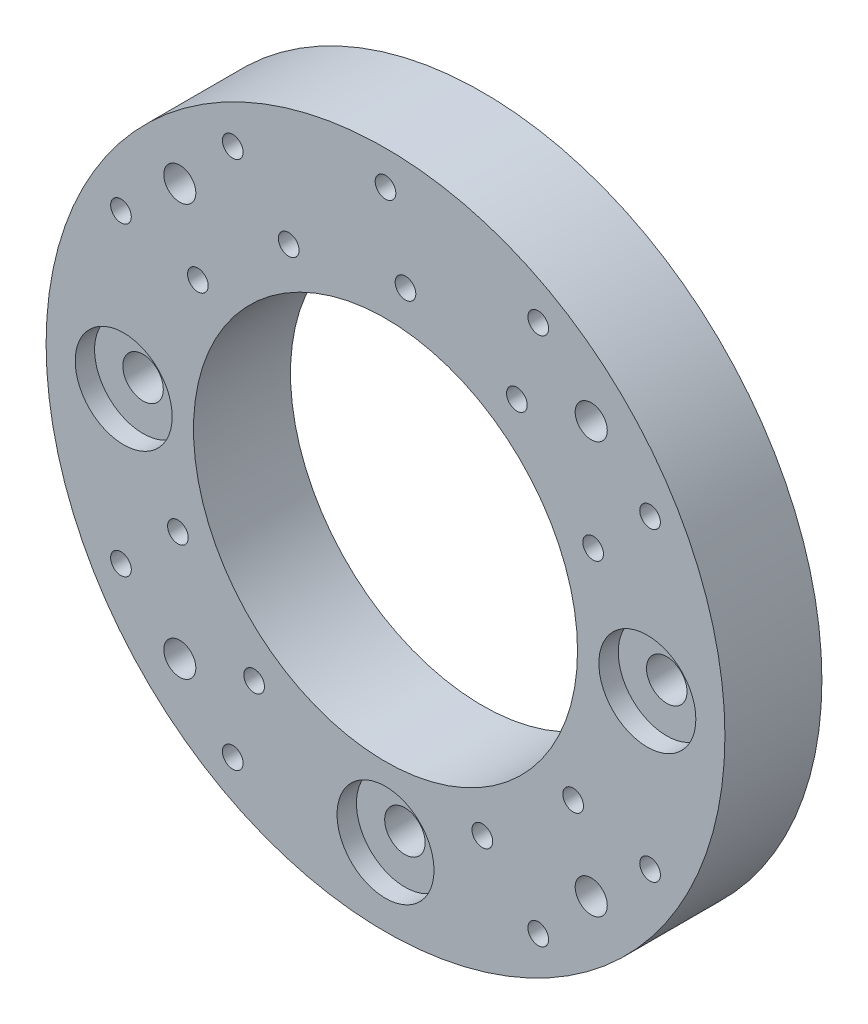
SolidWorks part; units mm, degrees
ref_plane "Front Plane" through (0, 0, 0) normal (0, 0, 1) x (1, 0, 0)
ref_plane "Top Plane" through (0, 0, 0) normal (0, 1, 0) x (1, 0, 0)
ref_plane "Right Plane" through (0, 0, 0) normal (1, 0, 0) x (0, 0, -1)
sketch "Sketch1" plane through (0, 0, 0) normal (0, 0, 1) x (1, 0, 0)
  circle A0 centre (0, 0) radius 25.146
  circle A1 centre (0, 0) radius 44.45
  dimension "D1" = 50.292
  dimension "D2" = 88.9
extrude "Boss-Extrude1" add sketch "Sketch1" along normal blind 12.7
sketch "Sketch2" plane through (0, 0, 0) normal (0, 0, -1) x (-1, 0, 0)
  line L0 (0, 0) -> (34.29, 0) construction
  line L1 (0, 0) -> (-34.29, 0) construction
  line L2 (0, 0) -> (0, -34.29) construction
  point P4 (0, -34.29)
  point P8 (34.29, 0)
  point P12 (-34.29, 0)
  dimension "D1" = 34.29
  dimension "D2" = 34.29
hole_wizard "CSK for M5 SFHCS1" positions "Sketch3" profile "Sketch4" countersink size "M5" standard "ANSI Metric"
sketch "Sketch3" plane through (0, 0, 0) normal (0, 0, -1) x (-1, 0, 0)
  point P0 (-34.29, 0)
  point P3 (0, -34.29)
  point P6 (34.29, 0)
sketch "Sketch4" plane through (34.29, 0, 0) normal (1, 0, 0) x (0, 1, 0)
  line L0 (0, 0) -> (0, 12.7)
  line L1 (0, 12.7) -> (2.65, 12.7)
  line L2 (2.65, 12.7) -> (2.65, 2.95)
  line L3 (2.65, 2.95) -> (5.6, 0)
  line L5 (5.6, 0) -> (0, 0)
  line L6 (-2.65, 2.95) -> (-5.6, 0) construction
  line L11 (0, -6.35) -> (0, 107.95) construction
  dimension "Thru Hole Dia." = 5.3
  dimension "Thru Hole Depth" = 12.7
  dimension "Near C'Sink Dia." = 11.2
  dimension "Near C'Sink Angle" = 90
sketch "Sketch6" plane through (0, 0, 12.7) normal (0, 0, 1) x (1, 0, 0)
  circle A0 centre (-34.29, 0) radius 6.35
  circle A1 centre (34.29, 0) radius 6.35
  circle A2 centre (0, -34.29) radius 6.35
  dimension "D1" = 12.7
extrude "Cut-Extrude1" cut sketch "Sketch6" against normal blind 2.54
sketch "Sketch9" plane through (0, 0, 0) normal (0, 0, -1) x (-1, 0, 0)
  line L0 (-26.9408, 26.9408) -> (0, 0) construction
  line L1 (0, 0) -> (26.9408, 26.9408) construction
  line L2 (0, 0) -> (-26.9408, -26.9408) construction
  line L3 (0, 0) -> (26.9408, -26.9408) construction
  line L4 (0, 0) -> (-18.2312, 0) construction
  point P0 (-26.9408, -26.9408)
  point P1 (26.9408, -26.9408)
  point P2 (26.9408, 26.9408)
  point P3 (-26.9408, 26.9408)
  dimension "D1" = 45
  dimension "D2" = 38.1
hole_wizard "M5 Tapped Hole1" positions "Sketch10" profile "Sketch11" tap size "M5" standard "AS"
sketch "Sketch10" plane through (0, 0, 12.7) normal (0, 0, 1) x (1, 0, 0)
  point P0 (-26.9408, 26.9408)
  point P3 (26.9408, 26.9408)
  point P6 (26.9408, -26.9408)
  point P9 (-26.9408, -26.9408)
sketch "Sketch11" plane through (-26.9408, 26.9408, 12.7) normal (1, 0, 0) x (0, -1, 0)
  line L0 (0, 0) -> (0, 10.7868)
  line L1 (0, 10.7868) -> (2.1, 9.525)
  line L2 (2.1, 9.525) -> (2.1, 0)
  line L5 (2.1, 0) -> (0, 0)
  line L10 (0, 10.7868) -> (-2.1, 9.525) construction
  line L11 (0, -6.35) -> (0, 107.95) construction
  dimension "Tap Drill Dia." = 4.2
  dimension "Tap Drill Depth" = 9.525
  dimension "Drill Angle" = 118
sketch "Sketch13" plane through (0, 0, 0) normal (0, 0, -1) x (-1, 0, 0)
  line L0 (0, 0) -> (0, 40.005) construction
  line L1 (0, 0) -> (12.6774, 27.1869) construction
  point P0 (0, 40.005)
  point P1 (12.6774, 27.1869)
  point P7 (-40.005, 0)
  point P9 (20.0025, 34.6453)
  point P10 (24.5724, 17.2058)
  point P11 (34.6453, 20.0025)
  point P14 (27.1869, -12.6774)
  point P15 (34.6453, -20.0025)
  point P16 (17.2058, -24.5724)
  point P17 (20.0025, -34.6453)
  point P20 (-12.6774, -27.1869)
  point P21 (-20.0025, -34.6453)
  point P22 (-24.5724, -17.2058)
  point P23 (-34.6453, -20.0025)
  point P25 (-29.8833, -2.6144)
  point P26 (-27.1869, 12.6774)
  point P27 (-34.6453, 20.0025)
  point P28 (-17.2058, 24.5724)
  point P29 (-20.0025, 34.6453)
  point P30 (-2.6144, 29.8833)
  point P31 (0, 0)
  point P32 (2.6144, -29.8833)
  point P33 (0, -40.005)
  point P34 (40.005, 0)
  point P35 (29.8833, 2.6144)
  dimension "D1" = 40.005
  dimension "D2" = 29.9974
  dimension "D3" = 25
  dimension "D5" = 29.9974
  dimension "D6" = 15.5278
  dimension "D4" = 12
hole_wizard "#6-32 Tapped Hole2" positions "Sketch16" profile "Sketch17" tap size "#6-32" standard "ANSI Inch"
sketch "Sketch16" plane through (0, 0, 0) normal (0, 0, -1) x (-1, 0, 0)
  point P0 (-17.2058, 24.5724)
  point P3 (-20.0025, 34.6453)
  point P6 (0, 40.005)
  point P9 (-2.6144, 29.8833)
  point P12 (20.0025, 34.6453)
  point P15 (12.6774, 27.1869)
  point P18 (24.5724, 17.2058)
  point P21 (34.6453, 20.0025)
  point P24 (27.1869, -12.6774)
  point P27 (34.6453, -20.0025)
  point P30 (20.0025, -34.6453)
  point P33 (17.2058, -24.5724)
  point P36 (-12.6774, -27.1869)
  point P39 (-20.0025, -34.6453)
  point P42 (-24.5724, -17.2058)
  point P45 (-34.6453, -20.0025)
  point P48 (-27.1869, 12.6774)
  point P51 (-34.6453, 20.0025)
sketch "Sketch17" plane through (17.2058, 24.5724, 0) normal (1, 0, 0) x (0, 1, 0)
  line L0 (0, 0) -> (0, 12.7)
  line L1 (0, 12.7) -> (1.3525, 12.7)
  line L2 (1.3525, 12.7) -> (1.3525, 0)
  line L5 (1.3525, 0) -> (0, 0)
  line L11 (0, -6.35) -> (0, 107.95) construction
  dimension "Thru Tap Drill Dia." = 2.7051
  dimension "Thru Tap Drill Depth" = 12.7
